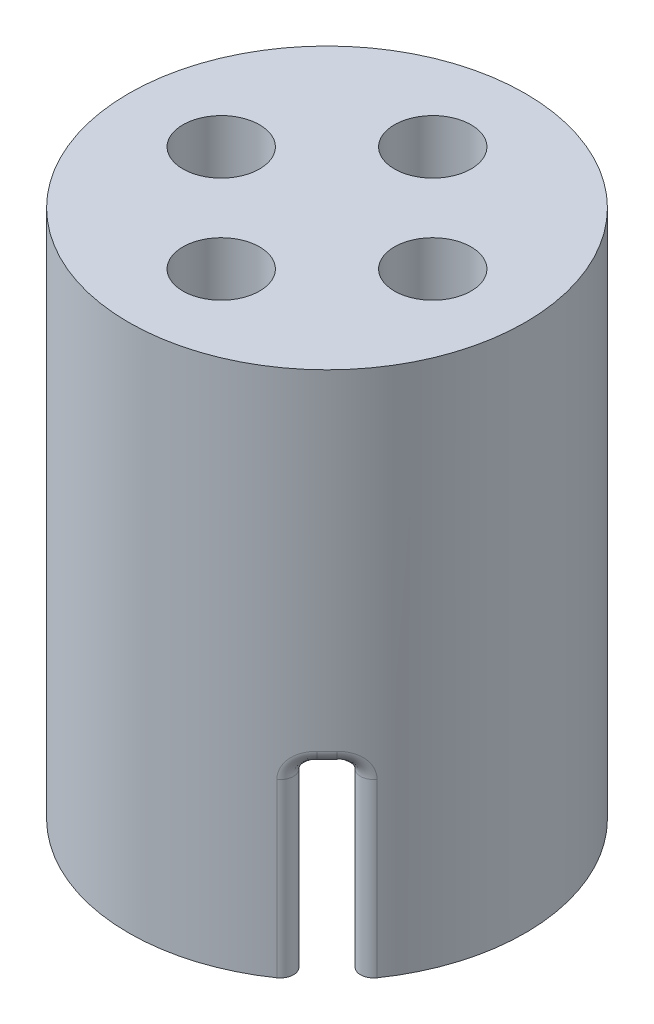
SolidWorks part; units mm, degrees
ref_plane "Front Plane" through (0, 0, 0) normal (0, 0, 1) x (1, 0, 0)
ref_plane "Top Plane" through (0, 0, 0) normal (0, 1, 0) x (1, 0, 0)
ref_plane "Right Plane" through (0, 0, 0) normal (1, 0, 0) x (0, 0, -1)
sketch "Sketch1" plane through (0, 0, 0) normal (0, 1, 0) x (1, 0, 0)
  circle A0 centre (-26.6773, 35.2865) radius 22.5 construction
  circle A1 centre (-10.1773, 35.2865) radius 1 construction
  circle A2 centre (-26.6773, 18.7865) radius 1 construction
  circle A3 centre (-43.1773, 35.2865) radius 1 construction
  circle A4 centre (-26.6773, 51.7865) radius 1 construction
  circle A5 centre (-26.6773, 35.2865) radius 22.5 construction
  circle A6 centre (-10.1773, 35.2865) radius 1
  circle A7 centre (-26.6773, 18.7865) radius 1
  circle A8 centre (-43.1773, 35.2865) radius 1
  circle A9 centre (-26.6773, 51.7865) radius 1
  circle A10 centre (-26.6773, 35.2865) radius 7.5
  circle A11 centre (-26.6773, 35.2865) radius 27.5
  circle A12 centre (-26.6773, 39.2865) radius 0.9
  circle A13 centre (-22.6773, 35.2865) radius 0.9
  circle A14 centre (-26.6773, 35.2865) radius 7.5
  circle A15 centre (-26.6773, 31.2865) radius 0.9
  circle A16 centre (-26.6773, 35.2865) radius 7.5
  circle A17 centre (-30.6773, 35.2865) radius 0.9
  circle A18 centre (-26.6773, 35.2865) radius 7.5
  point P32 (-26.6773, 35.2865)
  dimension "D1" = 15
  dimension "D3" = 1.8
  dimension "D4" = 4
  dimension "D2" = 5
  dimension "D5" = 4
extrude "Boss-Extrude1" add sketch "Sketch1" against normal blind 6 contours A11 A6 A7 A8 A9 A10 | A10 A17 A15 A13 A12
sketch "Sketch2" plane through (0, -6, 0) normal (0, -1, 0) x (1, 0, 0)
  circle A0 centre (-43.1773, -35.2865) radius 3.5
  circle A3 centre (-26.6773, -51.7865) radius 1
  circle A4 centre (-26.6773, -51.7865) radius 1
  circle A5 centre (-43.1773, -35.2865) radius 1
  circle A6 centre (-43.1773, -35.2865) radius 1
  circle A7 centre (-26.6773, -18.7865) radius 1
  circle A8 centre (-26.6773, -18.7865) radius 1
  circle A9 centre (-10.1773, -35.2865) radius 1
  circle A10 centre (-10.1773, -35.2865) radius 1
  circle A11 centre (-26.6773, -35.2865) radius 7.5
  circle A12 centre (-26.6773, -35.2865) radius 7.5
  circle A15 centre (-26.6773, -35.2865) radius 7.5
  circle A16 centre (-26.6773, -35.2865) radius 7.5
  circle A19 centre (-26.6773, -35.2865) radius 7.5
  circle A20 centre (-26.6773, -35.2865) radius 7.5
  circle A25 centre (-26.6773, -35.2865) radius 27.5
  circle A26 centre (-26.6773, -35.2865) radius 27.5
  circle A27 centre (-26.6773, -18.7865) radius 3.5
  circle A28 centre (-10.1773, -35.2865) radius 3.5
  circle A29 centre (-26.6773, -51.7865) radius 3.5
  dimension "D2" = 0
  dimension "D3" = 0
  dimension "D4" = 0
  dimension "D5" = 0
  dimension "D6" = 0
  dimension "D8" = 0
  dimension "D10" = 0
  dimension "D13" = 0
  dimension "D14" = 2.5
extrude "Cut-Extrude1" cut sketch "Sketch2" against normal blind 2 contours A0 M17 | A27 M16 | A28 M15 | A29 M18
sketch "Sketch3" plane through (0, 0, 0) normal (0, 1, 0) x (1, 0, 0)
  circle A0 centre (-26.6773, 31.2865) radius 0.9 construction
  circle A1 centre (-22.6773, 35.2865) radius 0.9 construction
  circle A2 centre (-30.6773, 35.2865) radius 0.9 construction
  circle A3 centre (-26.6773, 39.2865) radius 0.9 construction
  circle A4 centre (-26.6773, 31.2865) radius 0.9 construction
  circle A5 centre (-22.6773, 35.2865) radius 0.9 construction
  circle A6 centre (-30.6773, 35.2865) radius 0.9 construction
  circle A7 centre (-26.6773, 39.2865) radius 0.9 construction
  circle A8 centre (-26.6773, 31.2865) radius 1.9
  circle A9 centre (-22.6773, 35.2865) radius 1.9
  circle A10 centre (-30.6773, 35.2865) radius 1.9
  circle A11 centre (-26.6773, 39.2865) radius 1.9
  dimension "D1" = 1
extrude "Cut-Extrude2" cut sketch "Sketch3" against normal blind 2
sketch "Sketch4" plane through (0, -6, 0) normal (0, -1, 0) x (1, 0, 0)
  circle A1 centre (-26.6773, -35.2865) radius 7.5
  circle A2 centre (-26.6773, -35.2865) radius 7.5
  circle A11 centre (-26.6773, -35.2865) radius 7.5
  circle A12 centre (-26.6773, -35.2865) radius 7.5
  circle A13 centre (-30.6773, -35.2865) radius 0.9
  circle A14 centre (-30.6773, -35.2865) radius 0.9
  circle A15 centre (-26.6773, -35.2865) radius 7.5
  circle A16 centre (-26.6773, -35.2865) radius 7.5
  circle A17 centre (-26.6773, -31.2865) radius 0.9
  circle A18 centre (-26.6773, -31.2865) radius 0.9
  circle A19 centre (-26.6773, -35.2865) radius 7.5
  circle A20 centre (-26.6773, -35.2865) radius 7.5
  circle A21 centre (-22.6773, -35.2865) radius 0.9
  circle A22 centre (-22.6773, -35.2865) radius 0.9
  circle A23 centre (-26.6773, -39.2865) radius 0.9
  circle A24 centre (-26.6773, -39.2865) radius 0.9
  dimension "D1" = 0
  dimension "D6" = 0
  dimension "D7" = 0
  dimension "D8" = 0
  dimension "D9" = 0
  dimension "D10" = 0
  dimension "D11" = 0
  dimension "D12" = 0
extrude "Boss-Extrude2" add sketch "Sketch4" along normal blind 20
sketch "Sketch5" plane through (0, -26, 0) normal (0, -1, 0) x (1, 0, 0)
  line L0 (-26.6773, -35.2865) -> (-31.9806, -40.5898) construction
  line L1 (-26.6773, -35.2865) -> (-26.6773, -42.7865) construction
  line L2 (-21.9309, -29.4794) -> (-32.5109, -40.0595)
  line L3 (-20.8703, -30.5401) -> (-31.4503, -41.1201)
  line L4 (-27.2076, -34.7562) -> (-32.5109, -40.0595) construction
  line L5 (-26.147, -35.8168) -> (-31.4503, -41.1201) construction
  arc A0 (-20.8703, -30.5401) -> (-21.9309, -29.4794) centre (-26.6773, -35.2865) ccw
  circle A1 centre (-26.6773, -35.2865) radius 7.5
  arc A2 (-32.4843, -40.0329) -> (-26.6773, -42.7865) centre (-26.6773, -35.2865) ccw
  dimension "D2" = 45
  dimension "D1" = 0
  dimension "D3" = 0.75
  dimension "D4" = 0.75
extrude "Cut-Extrude3" cut sketch "Sketch5" against normal blind 7 contours L3 L2 M8
fillet "Fillet2" radius 0.5 8 edges at (-32.4843, -22.5, -40.0329) (-21.9309, -22.5, -29.4794) (-20.8703, -22.5, -30.5401) (-31.4237, -22.5, -41.0935) (-21.374, -19, -29.9832) (-31.9806, -19, -40.5898) (-27.2076, -19, -34.7562) (-26.147, -19, -35.8168)
sketch "Sketch6" plane through (0, 0, 0) normal (0, 1, 0) x (1, 0, 0)
  circle A1 centre (-26.6773, 35.2865) radius 27.5
  circle A2 centre (-26.6773, 35.2865) radius 27.5
  dimension "D1" = 0
extrude "Cut-Extrude4" cut sketch "Sketch6" against normal up to surface (6 mm away)
sketch "Sketch7" plane through (0, -6, 0) normal (0, 1, 0) x (1, 0, 0)
  circle A5 centre (-22.6773, 35.2865) radius 1.45
  circle A6 centre (-26.6773, 31.2865) radius 1.45
  circle A7 centre (-30.6773, 35.2865) radius 1.45
  circle A8 centre (-26.6773, 39.2865) radius 1.45
  point P1 (-31.1087, 31.0773)
  point P3 (-30.6773, 35.2865)
  point P5 (-27.3979, 37.9705)
  point P7 (-26.6773, 39.5438)
  point P13 (-26.6773, 39.2195)
  point P14 (-26.6773, 39.2865)
  point P16 (-22.6662, 35.2865)
  point P17 (0, 0)
  point P18 (-22.6773, 35.2865)
  point P20 (-26.6773, 31.2865)
  dimension "D1" = 2.9
extrude "Cut-Extrude5" cut sketch "Sketch7" against normal through all
